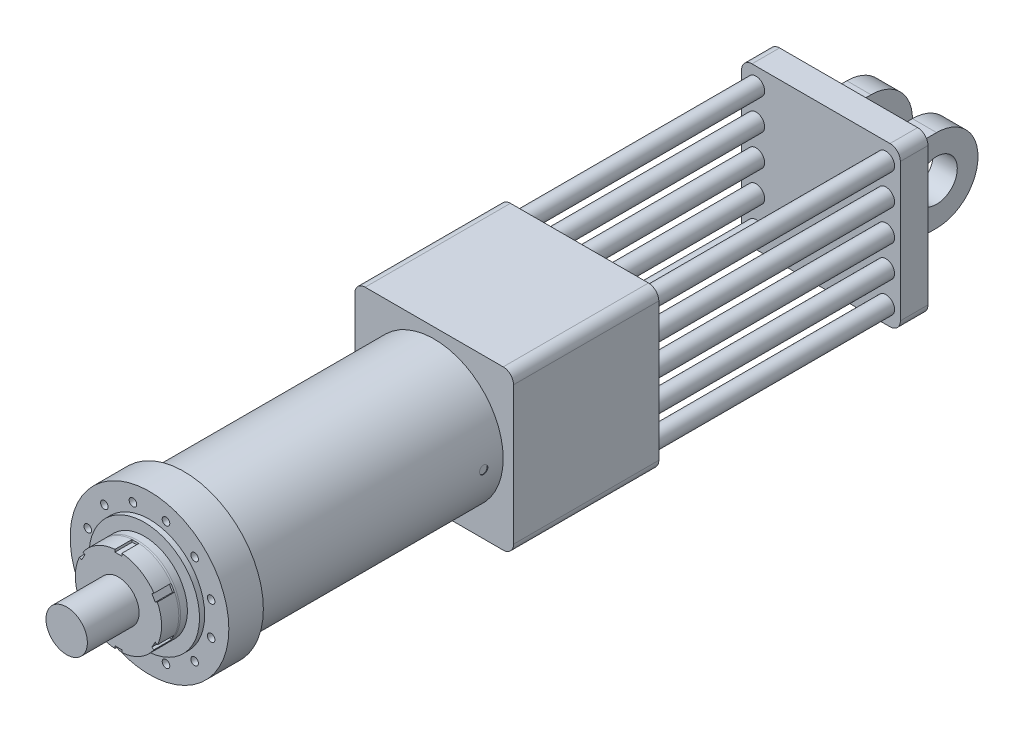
SolidWorks part; units mm, degrees
ref_plane "前视基准面" through (0, 0, 0) normal (0, 0, 1) x (1, 0, 0)
ref_plane "上视基准面" through (0, 0, 0) normal (0, 1, 0) x (1, 0, 0)
ref_plane "右视基准面" through (0, 0, 0) normal (1, 0, 0) x (0, 0, -1)
sketch "草图1" plane through (0, 0, 0) normal (0, 0, 1) x (1, 0, 0)
  circle A0 centre (0, 0) radius 200
  dimension "D1" = 400
extrude "凸台-拉伸1" add sketch "草图1" along normal blind 725
sketch "草图2" plane through (0, 0, 725) normal (0, 0, 1) x (1, 0, 0)
  line L0 (0, 0) -> (351.3656, 0) construction
  line L1 (0, 0) -> (299.4379, 80.2342) construction
  circle A0 centre (0, 0) radius 230
  circle A1 centre (0, 0) radius 185 construction
  circle A2 centre (178.6963, 47.8815) radius 11
  circle A3 centre (178.6963, -47.8815) radius 11
  circle A4 centre (130.8148, -130.8148) radius 11
  circle A5 centre (47.8815, -178.6963) radius 11
  circle A6 centre (-47.8815, -178.6963) radius 11
  circle A7 centre (-130.8148, -130.8148) radius 11
  circle A8 centre (-178.6963, -47.8815) radius 11
  circle A9 centre (-178.6963, 47.8815) radius 11
  circle A10 centre (-130.8148, 130.8148) radius 11
  circle A11 centre (-47.8815, 178.6963) radius 11
  circle A12 centre (47.8815, 178.6963) radius 11
  circle A13 centre (130.8148, 130.8148) radius 11
  point P32 (0, 0)
  dimension "D1" = 460
  dimension "D2" = 370
  dimension "D4" = 22
  dimension "D3" = 15
  dimension "D5" = 12
extrude "凸台-拉伸2" add sketch "草图2" along normal blind 100
sketch "草图3" plane through (0, 0, 825) normal (0, 0, 1) x (1, 0, 0)
  circle A0 centre (0, 0) radius 160
  dimension "D1" = 320
extrude "凸台-拉伸3" add sketch "草图3" along normal blind 15
sketch "草图4" plane through (0, 0, 840) normal (0, 0, 1) x (1, 0, 0)
  circle A1 centre (0, 0) radius 125
  dimension "D1" = 250
extrude "凸台-拉伸4" add sketch "草图4" along normal blind 25
chamfer "倒角1" distance 5 angle 10 1 edges at (125, 0, 865)
sketch "草图5" plane through (0, 0, 865) normal (0, 0, 1) x (1, 0, 0)
  line L0 (-10, 124.5994) -> (-10, 117.5)
  line L1 (-10, 117.5) -> (10, 117.5)
  line L2 (10, 117.5) -> (10, 124.5994)
  line L3 (102.9062, 70.9599) -> (96.758, 67.4103)
  line L4 (96.758, 67.4103) -> (106.758, 50.0897)
  line L5 (106.758, 50.0897) -> (112.9062, 53.6394)
  line L6 (112.9062, -53.6394) -> (106.758, -50.0897)
  line L7 (106.758, -50.0897) -> (96.758, -67.4103)
  line L8 (96.758, -67.4103) -> (102.9062, -70.9599)
  line L9 (10, -124.5994) -> (10, -117.5)
  line L10 (10, -117.5) -> (-10, -117.5)
  line L11 (-10, -117.5) -> (-10, -124.5994)
  line L12 (-102.9062, -70.9599) -> (-96.758, -67.4103)
  line L13 (-96.758, -67.4103) -> (-106.758, -50.0897)
  line L14 (-106.758, -50.0897) -> (-112.9062, -53.6394)
  line L15 (-112.9062, 53.6394) -> (-106.758, 50.0897)
  line L16 (-106.758, 50.0897) -> (-96.758, 67.4103)
  line L17 (-96.758, 67.4103) -> (-102.9062, 70.9599)
  arc A0 (-10, 124.5994) -> (-102.9062, 70.9599) centre (0, 0) ccw
  arc A1 (-112.9062, 53.6394) -> (-112.9062, -53.6394) centre (0, 0) ccw
  arc A2 (-102.9062, -70.9599) -> (-10, -124.5994) centre (0, 0) ccw
  arc A3 (10, -124.5994) -> (102.9062, -70.9599) centre (0, 0) ccw
  arc A4 (112.9062, -53.6394) -> (112.9062, 53.6394) centre (0, 0) ccw
  arc A5 (102.9062, 70.9599) -> (10, 124.5994) centre (0, 0) ccw
  point P28 (0, 0)
  dimension "D1" = 250
  dimension "D2" = 20
  dimension "D3" = 10
  dimension "D4" = 117.5
  dimension "D5" = 6
sketch "草图6" plane through (0, 0, 0) normal (0, 0, -1) x (-1, 0, 0)
  line L1 (-230, 230) -> (230, 230)
  line L2 (-230, 230) -> (-230, -230)
  line L3 (-230, -230) -> (230, -230)
  line L4 (230, 230) -> (230, -230)
  line L5 (-230, 230) -> (230, -230) construction
  line L6 (-230, -230) -> (230, 230) construction
  circle A0 centre (0, 0) radius 230 construction
  dimension "D1" = 460
  dimension "D2" = 460
  dimension "D3" = 460
extrude "凸台-拉伸6" add sketch "草图6" along normal blind 421
ref_plane "基准面1" through (-200, 0, 0) normal (1, 0, 0) x (0, 0, -1)
sketch "草图9" plane through (-200, 0, 0) normal (1, 0, 0) x (0, 0, -1)
  line L0 (-725, -200) -> (-725, 200) construction
  circle A0 centre (-36.5, 0) radius 12
  circle A1 centre (-670.5, 0) radius 12
  dimension "D1" = 24
  dimension "D2" = 24
  dimension "D3" = 36.5
  dimension "D4" = 54.5
extrude "切除-拉伸2" cut sketch "草图9" along normal blind 2
ref_plane "基准面2" through (200, 0, 0) normal (1, 0, 0) x (0, 0, -1)
sketch "草图10" plane through (200, 0, 0) normal (1, 0, 0) x (0, 0, -1)
  circle A0 centre (-56.5, 0) radius 12
  dimension "D1" = 56.5
  dimension "D2" = 24
extrude "切除-拉伸3" cut sketch "草图10" against normal blind 2
extrude "凸台-拉伸7" add sketch "草图5" along normal blind 50
sketch "草图11" plane through (0, 0, 915) normal (0, 0, 1) x (1, 0, 0)
  circle A0 centre (0, 0) radius 60
  dimension "D1" = 120
extrude "凸台-拉伸8" add sketch "草图11" along normal blind 150
sketch "草图12" plane through (0, 0, -421) normal (0, 0, -1) x (-1, 0, 0)
  line L0 (0, 0) -> (0, 115.5989) construction
  line L1 (-230, -230) -> (230, -230) construction
  circle A0 centre (-188.2698, 180) radius 25
  circle A1 centre (-188.2698, 90) radius 25
  circle A2 centre (-188.2698, 0) radius 25
  circle A3 centre (-188.2698, -90) radius 25
  circle A4 centre (-188.2698, -180) radius 25
  circle A5 centre (188.2698, -180) radius 25
  circle A6 centre (188.2698, -90) radius 25
  circle A7 centre (188.2698, 0) radius 25
  circle A8 centre (188.2698, 90) radius 25
  circle A9 centre (188.2698, 180) radius 25
  point P13 (0, 0)
  dimension "D1" = 50
  dimension "D2" = 50
  dimension "D3" = 90
  dimension "D4" = 90
  dimension "D5" = 90
  dimension "D6" = 90
extrude "凸台-拉伸9" add sketch "草图12" along normal blind 700
sketch "草图13" plane through (0, 0, -1121) normal (0, 0, -1) x (-1, 0, 0)
  line L5 (-230, 230) -> (230, 230)
  line L6 (-230, 230) -> (-230, -230)
  line L7 (-230, -230) -> (230, -230)
  line L8 (230, 230) -> (230, -230)
  line L9 (-230, 230) -> (230, -230) construction
  line L10 (-230, -230) -> (230, 230) construction
  point P0 (0, 0)
  point P9 (0, 0)
  dimension "D1" = 460
  dimension "D2" = 460
extrude "凸台-拉伸10" add sketch "草图13" along normal blind 80
fillet "圆角1" radius 30 8 edges at (230, -230, -1161) (230, -230, -210.5) (230, 230, -1161) (230, 230, -210.5) (-230, -230, -1161) (-230, -230, -210.5) (-230, 230, -1161) (-230, 230, -210.5)
sketch "草图14" plane through (0, 0, -1201) normal (0, 0, -1) x (-1, 0, 0)
  line L0 (-95, 0) -> (95, 0) construction
  line L2 (-130, 120) -> (-60, 120)
  line L3 (-130, 120) -> (-130, -120)
  line L4 (-130, -120) -> (-60, -120)
  line L5 (-60, 120) -> (-60, -120)
  line L6 (-130, 120) -> (-60, -120) construction
  line L7 (-130, -120) -> (-60, 120) construction
  line L8 (60, 120) -> (130, 120)
  line L9 (60, 120) -> (60, -120)
  line L10 (60, -120) -> (130, -120)
  line L11 (130, 120) -> (130, -120)
  line L12 (60, 120) -> (130, -120) construction
  line L13 (60, -120) -> (130, 120) construction
  point P4 (0, 0)
  dimension "D1" = 260
  dimension "D2" = 120
  dimension "D3" = 70
  dimension "D4" = 240
  dimension "D5" = 240
extrude "凸台-拉伸11" add sketch "草图14" along normal blind 245
sketch "草图15" plane through (-130, 0, 0) normal (-1, 0, 0) x (0, 0, 1)
  line L0 (-1446, 0) -> (-1326, 0) construction
  line L1 (-1446, -120) -> (-1446, 120) construction
  line L2 (-1326, 120) -> (-1551.8555, 168.0723)
  line L3 (-1551.8555, 168.0723) -> (-1541.3263, -184.3049)
  line L4 (-1541.3263, -184.3049) -> (-1326, -120)
  arc A0 (-1326, 120) -> (-1326, -120) centre (-1326, 0) ccw
  circle A1 centre (-1326, 0) radius 60
  dimension "D1" = 120
  dimension "D2" = 120
extrude "切除-拉伸4" cut sketch "草图15" against normal blind 260
chamfer "倒角2" distance 20 angle 45 7 edges at (-95, -120, -1201) (-130, 0, -1201) (-95, 120, -1201) (130, 0, -1201) (95, -120, -1201) (60, 0, -1201) (95, 120, -1201)
